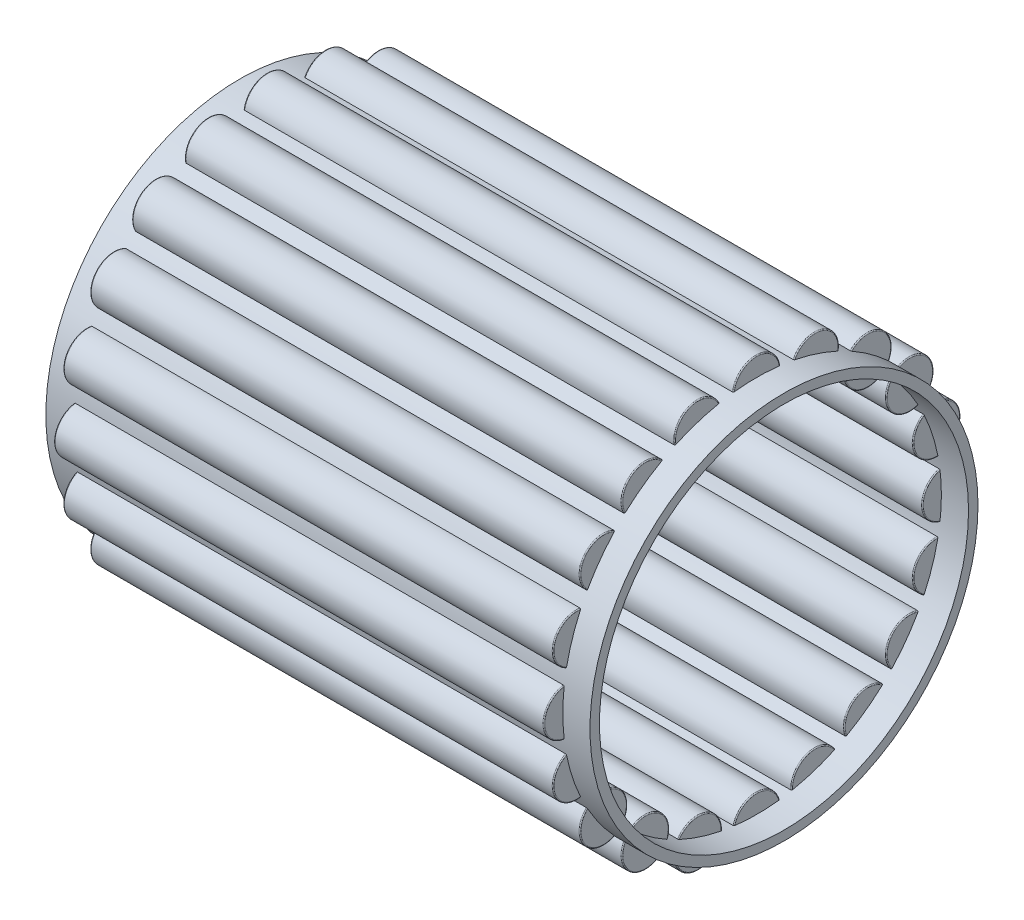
SolidWorks part; units mm, degrees
ref_plane "Plane1" through (0, 0, 0) normal (0, 0, 1) x (1, 0, 0)
ref_plane "Plane2" through (0, 0, 0) normal (0, 1, 0) x (1, 0, 0)
ref_plane "Plane3" through (0, 0, 0) normal (1, 0, 0) x (0, 0, -1)
sketch "Clipboard" plane through (0, 0, 0) normal (0, 0, 1) x (1, 0, 0)
  line L0 (-10, 0) -> (10, 0) construction
  line L1 (-21, -0.7333) -> (0.0122, -8.3811)
  line L2 (-21, -0.7333) -> (-4.0855, 5.423)
  line L3 (-21, -0.7333) -> (-13, -3.6451)
  line L4 (-21, -0.7333) -> (-35, -1.2222)
  dimension "OD" = 18
  dimension "Count" = 20
  dimension "Show_count" = 20
  dimension "Max_count" = 20
  dimension "Min_count" = 2
  dimension "RollCLRad" = 8
  dimension "Bore" = 14
sketch "CagSpiSke" plane through (0, 0, 0) normal (0, 0, 1) x (1, 0, 0)
  line L0 (11.5, 7.8) -> (11.5, 8.2)
  line L1 (11.5, 8.2) -> (-11.5, 8.2)
  line L2 (-11.5, 8.2) -> (-11.5, 7.8)
  line L3 (-11.5, 7.8) -> (11.5, 7.8)
  line L4 (-12.7, 0) -> (12.7, 0) construction
  dimension "cagRadius" = 7.8
  dimension "thickness" = 0.4
  dimension "Width" = 23
  dimension "halfWidth" = 11.5
revolve "CageSpine" add sketch "CagSpiSke" angle 360 about L4
sketch "RolDetSke" plane through (0, 0, 0) normal (0, 0, 1) x (1, 0, 0)
  line L0 (-17.78, 8) -> (17.78, 8) construction
  line L2 (-10.31, 9) -> (10.31, 9)
  line L3 (-10.35, 8.96) -> (-10.35, 8)
  line L5 (-10.35, 8) -> (10.35, 8)
  line L6 (10.35, 8.96) -> (10.35, 8)
  arc A0 (-10.31, 9) -> (-10.35, 8.96) centre (-10.31, 8.96) ccw
  arc A1 (10.35, 8.96) -> (10.31, 9) centre (10.31, 8.96) ccw
  dimension "radius" = 0.04
  dimension "Roller_diameter" = 2
  dimension "Cyl_Len" = 20.7
  dimension "CLRad" = 8
  dimension "halfCylLen" = 10.35
revolve "RollerDetailed" add sketch "RolDetSke" angle 360 about L0
ref_axis "Axis1" through (-50, 0, 0) along (1, 0, 0)
pattern_circular "RollersDetailed" count 20 every 18 about axis through (-50, 0, 0) along (1, 0, 0) of "RollerDetailed"
sketch "RolSimSke" plane through (0, 0, 0) normal (0, 0, 1) x (1, 0, 0)
  line L0 (-17.78, 0) -> (17.78, 0) construction
  line L1 (-12.7, 0) -> (-38.1, 0) construction
  line L3 (-10.31, 9) -> (10.31, 9)
  line L4 (-10.35, 8.96) -> (-10.35, 7.04)
  line L5 (-10.31, 7) -> (10.31, 7)
  line L6 (10.35, 8.96) -> (10.35, 7.04)
  arc A0 (10.35, 7.04) -> (10.31, 7) centre (10.31, 7.04) cw
  arc A1 (10.31, 9) -> (10.35, 8.96) centre (10.31, 8.96) cw
  arc A2 (-10.35, 8.96) -> (-10.31, 9) centre (-10.31, 8.96) cw
  arc A3 (-10.31, 7) -> (-10.35, 7.04) centre (-10.31, 7.04) cw
  point P13 (10.35, 9)
  point P16 (-10.35, 9)
  point P19 (-10.35, 7)
  dimension "radius" = 0.04
  dimension "D1" = 10.35
  dimension "Cyl_Len" = 20.7
  dimension "Bore" = 14
  dimension "Roller_diameter" = 2
revolve "RollersSimplified" [suppressed] add sketch "RolSimSke" angle 360 about L0
equation "\"RollCLRad@Clipboard\" = ( \"OD@Clipboard\" + \"Bore@Clipboard\" )  / 4"
equation "\"CLRad@RolDetSke\" = \"RollCLRad@Clipboard\""
equation "\"thickness@CagSpiSke\"  = ( \"OD@Clipboard\" - \"Bore@Clipboard\" )  / 10"
equation "\"cagRadius@CagSpiSke\" =  \"RollCLRad@Clipboard\" -  ( \"thickness@CagSpiSke\" / 2 ) "
equation "\"halfWidth@CagSpiSke\" = \"Width@CagSpiSke\" / 2"
equation "\"Bore@RolSimSke\" = \"Bore@Clipboard\""
equation "\"Roller_diameter@RolDetSke\" =  ( \"OD@Clipboard\" - \"Bore@Clipboard\" )  / 2"
equation "\"halfCylLen@RolDetSke\" = \"Cyl_Len@RolDetSke\" / 2"
equation "\"radius@RolDetSke\" = \"Roller_diameter@RolDetSke\" / 50"
equation "\"Cyl_Len@RolSimSke\" = \"Cyl_Len@RolDetSke\""
equation "\"D1@RolSimSke\" = \"Cyl_Len@RolSimSke\"/2"
equation "\"radius@RolSimSke\" = \"radius@RolDetSke\""
equation "\"Roller_diameter@RolSimSke\" =  ( \"OD@Clipboard\" - \"Bore@Clipboard\" )  / 2"
equation "\"Max_count@Clipboard\" = int( 3.14159265 / atn(( \"Roller_diameter@RolDetSke\" / 2) / sqr(\"RollCLRad@Clipboard\"  * \"RollCLRad@Clipboard\" - ( \"Roller_diameter@RolDetSke\" / 2) *  ( \"Roller_diameter@RolDetS"
equation "\"Max_count@Clipboard\" = ((sgn( \"Max_count@Clipboard\" - \"Count@Clipboard\" )-1)*( \"Max_count@Clipboard\" - \"Count@Clipboard\" ))/-2+ \"Count@Clipboard\""
equation "\"Count@RollersDetailed\" = int( \"Show_count@Clipboard\" ) "
equation "\"Count@RollersDetailed\" = ((sgn( \"Count@RollersDetailed\" - \"Max_count@Clipboard\" )-1)*( \"Count@RollersDetailed\" - \"Max_count@Clipboard\" ))/-2+ \"Max_count@Clipboard\""
equation "\"Count@RollersDetailed\" = ((sgn( \"Count@RollersDetailed\" - \"Min_count@Clipboard\" )+1)*( \"Count@RollersDetailed\" - \"Min_count@Clipboard\"))/2 +\"Min_count@Clipboard\""
equation "\"Angle@RollersDetailed\" = 360.0 / \"Max_count@Clipboard\""
